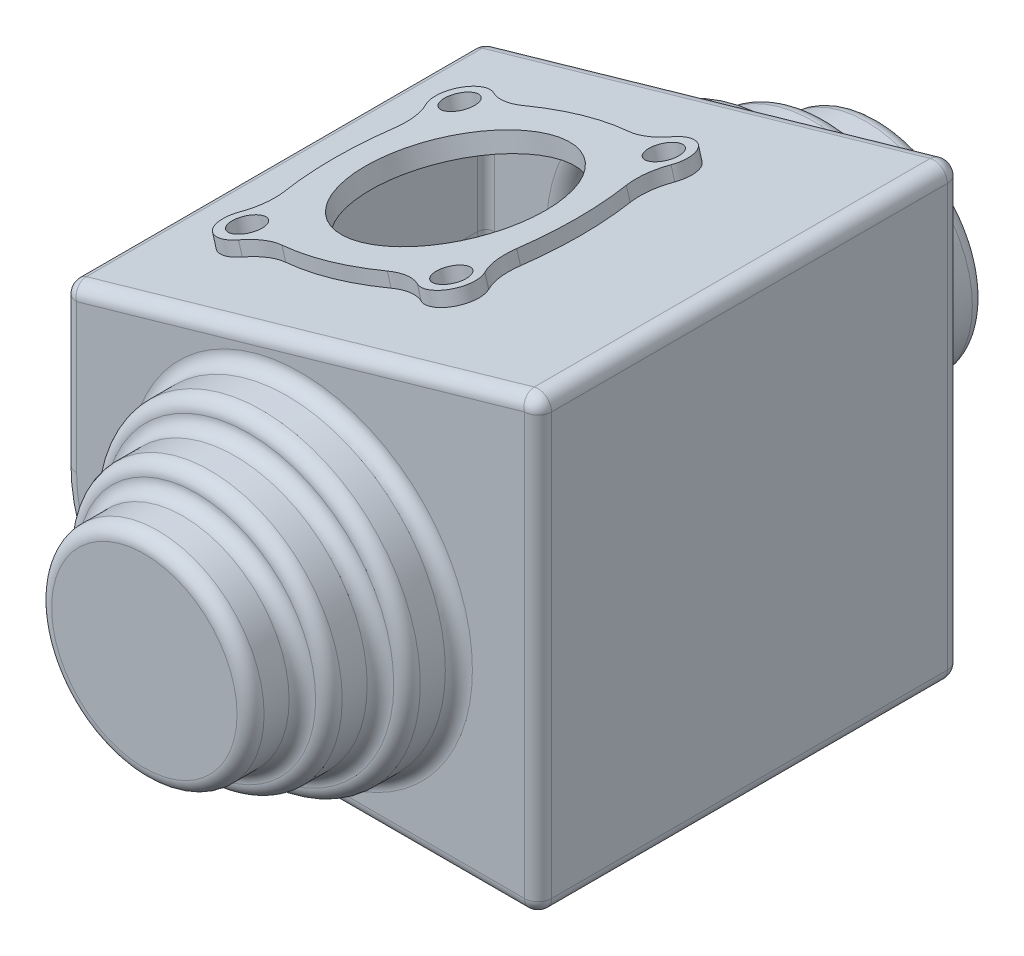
SolidWorks part; units mm, degrees
ref_plane "Front Plane" through (0, 0, 0) normal (0, 0, 1) x (1, 0, 0)
ref_plane "Top Plane" through (0, 0, 0) normal (0, 1, 0) x (1, 0, 0)
ref_plane "Right Plane" through (0, 0, 0) normal (1, 0, 0) x (0, 0, -1)
sketch "Sketch2" plane through (0, 0, 0) normal (0, 0, 1) x (1, 0, 0)
  line L0 (114, 128.3779) -> (-114, 63)
  line L1 (-114, 63) -> (-114, -13)
  line L3 (-38, -89) -> (114, -89)
  line L4 (114, -89) -> (114, 128.3779)
  arc A0 (-114, -13) -> (-38, -89) centre (-38, -13) ccw
  point P5 (105.8764, 128.3779)
  point P7 (0, 0)
  point P8 (0, 0)
  dimension "D2" = 76
  dimension "D4" = 228
  dimension "D1" = 106
  dimension "D3" = 152
  dimension "D5" = 89
  dimension "D6" = 114
extrude "Boss-Extrude1" add sketch "Sketch2" along normal mid plane 203
sketch "Sketch4" plane through (0, 0, 101.5) normal (0, 0, 1) x (1, 0, 0)
  circle A0 centre (0, 0) radius 76
  dimension "D1" = 152
extrude "Boss-Extrude2" add sketch "Sketch4" along normal blind 25
sketch "Sketch5" plane through (0, 0, 126.5) normal (0, 0, 1) x (1, 0, 0)
  circle A0 centre (0, 0) radius 63.5
  dimension "D1" = 127
extrude "Boss-Extrude3" add sketch "Sketch5" along normal blind 25
sketch "Sketch6" plane through (0, 0, 151.5) normal (0, 0, 1) x (1, 0, 0)
  circle A0 centre (0, 0) radius 51
  dimension "D1" = 102
extrude "Boss-Extrude4" add sketch "Sketch6" along normal blind 25
mirror "Mirror1" about plane through (0, 0, 0) normal (0, 0, 1) of "Boss-Extrude4", "Boss-Extrude3", "Boss-Extrude2"
fillet "Fillet1" radius 6.5 4 edges at (76, 0, -101.5) (51, 0, -176.5) (51, 0, -151.5) (63.5, 0, -126.5)
fillet "Fillet2" radius 6.5 4 edges at (63.5, 0, -151.5) (63.5, 0, 151.5) (51, 0, 176.5) (76, 0, -126.5)
fillet "Fillet3" radius 6.5 2 edges at (51, 0, 151.5) (63.5, 0, 126.5)
fillet "Fillet4" radius 6.5 15 edges at (76, 0, 126.5) (38, -89, -101.5) (-91.7401, -66.7401, -101.5) (-114, 25, 101.5) (-91.7401, -66.7401, 101.5) (76, 0, 101.5) (-114, 63, 0) (114, 19.689, -101.5) (114, 128.3779, 0) (0, 95.689, -101.5) (-114, 25, -101.5) (114, -89, 0) (38, -89, 101.5) (114, 19.689, 101.5) (0, 95.689, 101.5)
shell "Shell1" thickness 2.5
sketch "Sketch7" plane through (-25.3537, 88.4189, 0) normal (-0.2756, 0.9613, 0) x (0.9613, 0.2756, 0)
  line L0 (-31.5, 82.4444) -> (31.5, 82.4444) construction
  line L1 (82.4444, -31.5) -> (82.4444, 31.5) construction
  line L3 (-87.3206, 95) -> (-87.3206, -95) construction
  circle A21 centre (0, 0) radius 45
  arc A22 (61.1982, 44.6757) -> (44.6757, 61.1982) centre (51, 51) ccw
  arc A23 (-61.1982, 44.6757) -> (-44.6757, 61.1982) centre (-51, 51) cw
  arc A24 (-61.1982, -44.6757) -> (-44.6757, -61.1982) centre (-51, -51) ccw
  arc A25 (61.1982, -44.6757) -> (44.6757, -61.1982) centre (51, -51) cw
  arc A26 (57.9871, 26.3191) -> (57.9871, -26.3191) centre (-66.2558, 0) cw
  arc A27 (57.9871, 26.3191) -> (61.1982, 44.6757) centre (82.4444, 31.5) cw
  arc A28 (57.9871, -26.3191) -> (61.1982, -44.6757) centre (82.4444, -31.5) ccw
  circle A29 centre (51, 51) radius 7.5
  circle A30 centre (-51, 51) radius 7.5
  circle A31 centre (-51, -51) radius 7.5
  circle A32 centre (51, -51) radius 7.5
  arc A33 (-57.9871, -26.3191) -> (-61.1982, -44.6757) centre (-82.4444, -31.5) cw
  arc A34 (-57.9871, 26.3191) -> (-57.9871, -26.3191) centre (66.2558, 0) ccw
  arc A35 (-57.9871, 26.3191) -> (-61.1982, 44.6757) centre (-82.4444, 31.5) ccw
  arc A36 (26.3191, 57.9871) -> (-26.3191, 57.9871) centre (0, -66.2558) ccw
  arc A37 (-26.3191, 57.9871) -> (-44.6757, 61.1982) centre (-31.5, 82.4444) cw
  arc A38 (26.3191, 57.9871) -> (44.6757, 61.1982) centre (31.5, 82.4444) ccw
  arc A39 (26.3191, -57.9871) -> (44.6757, -61.1982) centre (31.5, -82.4444) cw
  arc A40 (26.3191, -57.9871) -> (-26.3191, -57.9871) centre (0, 66.2558) cw
  arc A41 (-26.3191, -57.9871) -> (-44.6757, -61.1982) centre (-31.5, -82.4444) ccw
  dimension "D1" = 90
  dimension "D2" = 15
  dimension "D3" = 12
  dimension "D4" = 127
  dimension "D5" = 25
  dimension "D6" = 4.8762
  dimension "D7" = 21.0648
  dimension "D8" = 26.1224
  dimension "D9" = 29.3335
  dimension "D10" = 12.5556
extrude "Boss-Extrude5" add sketch "Sketch7" along normal blind 6.5
sketch "Sketch8" plane through (-25.3537, 88.4189, 0) normal (-0.2756, 0.9613, 0) x (0.9613, 0.2756, 0)
  circle A0 centre (-51, 51) radius 7.5 construction
  circle A1 centre (-51, -51) radius 7.5 construction
  circle A2 centre (51, -51) radius 7.5 construction
  circle A3 centre (51, 51) radius 7.5 construction
  circle A4 centre (0, 0) radius 45 construction
  circle A5 centre (-51, 51) radius 7.5
  circle A6 centre (-51, -51) radius 7.5
  circle A7 centre (51, -51) radius 7.5
  circle A8 centre (51, 51) radius 7.5
  circle A9 centre (0, 0) radius 45
extrude "Cut-Extrude1" cut sketch "Sketch8" against normal up to next
